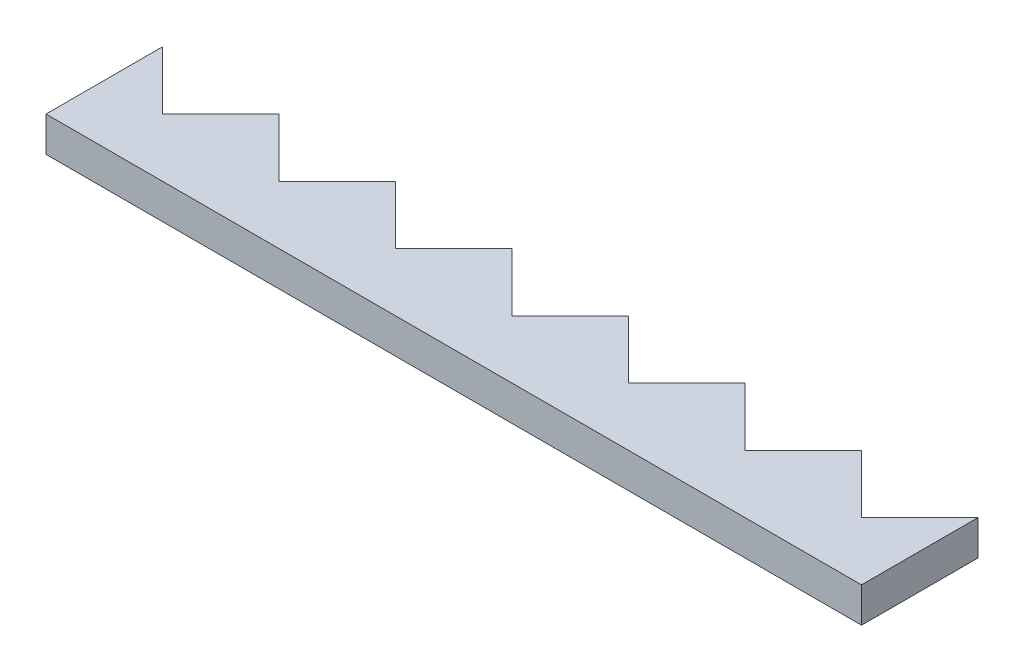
SolidWorks part; units mm, degrees
ref_plane "Front Plane" through (0, 0, 0) normal (0, 0, 1) x (1, 0, 0)
ref_plane "Top Plane" through (0, 0, 0) normal (0, 1, 0) x (1, 0, 0)
ref_plane "Right Plane" through (0, 0, 0) normal (1, 0, 0) x (0, 0, -1)
sketch "Sketch1" plane through (0, 3, 0) normal (0, 1, 0) x (1, 0, 0)
  line L0 (0, 0) -> (0, 10)
  line L1 (0, 10) -> (5, 5)
  line L2 (5, 5) -> (10, 10)
  line L3 (0, 10) -> (70.0805, 10) construction
  line L4 (10, 10) -> (15, 5)
  line L5 (15, 5) -> (20, 10)
  line L6 (20, 10) -> (25, 5)
  line L7 (25, 5) -> (30, 10)
  line L8 (30, 10) -> (35, 5)
  line L9 (35, 5) -> (40, 10)
  line L10 (40, 10) -> (45, 5)
  line L11 (45, 5) -> (50, 10)
  line L12 (50, 10) -> (55, 5)
  line L13 (55, 5) -> (60, 10)
  line L14 (60, 10) -> (65, 5)
  line L15 (65, 5) -> (70, 10)
  line L16 (0, 0) -> (70, 0)
  line L17 (70, 0) -> (70, 10)
  dimension "D1" = 10
  dimension "D2" = 10
  dimension "D3" = 5
  dimension "D4" = 7
extrude "Boss-Extrude1" add sketch "Sketch1" along normal blind 3
